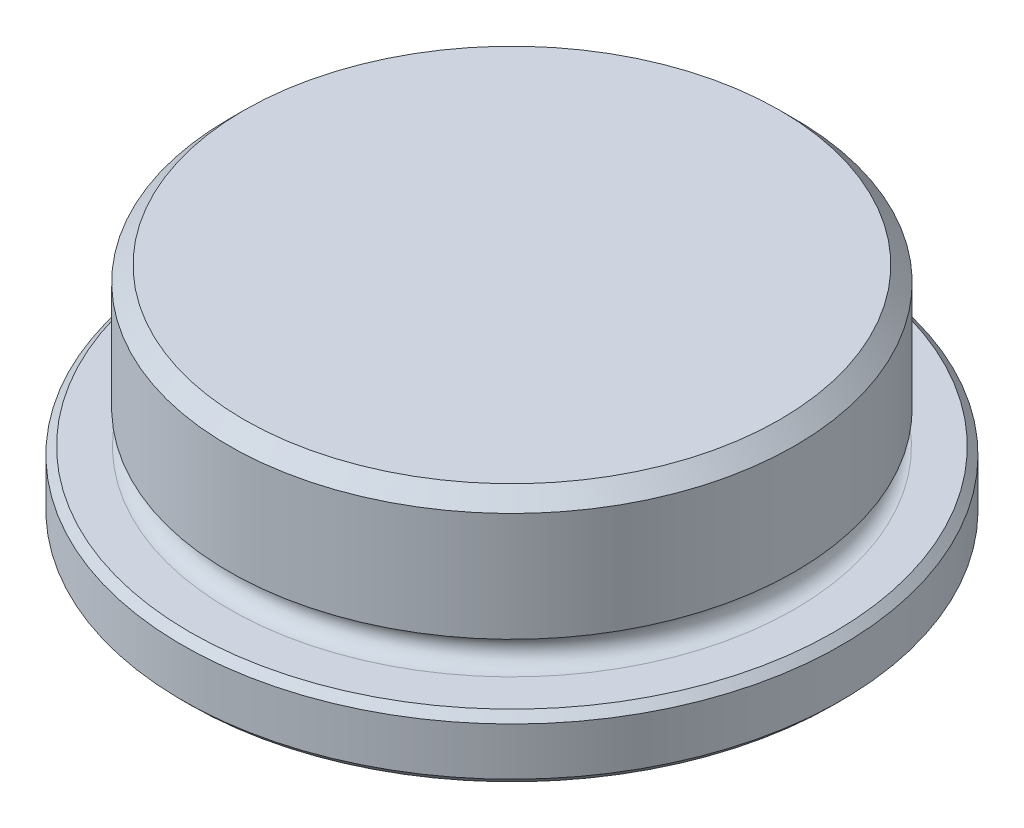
SolidWorks part; units mm, degrees
ref_plane "Front Plane" through (0, 0, 0) normal (0, 0, 1) x (1, 0, 0)
ref_plane "Top Plane" through (0, 0, 0) normal (0, 1, 0) x (1, 0, 0)
ref_plane "Right Plane" through (0, 0, 0) normal (1, 0, 0) x (0, 0, -1)
sketch "Sketch1" plane through (0, 0, 0) normal (0, 0, 1) x (1, 0, 0)
  line L0 (0, 0) -> (16.256, 0)
  line L1 (16.637, 0.381) -> (16.637, 2.794)
  line L2 (16.256, 3.175) -> (14.6662, 3.175)
  line L3 (14.2875, 4.8356) -> (14.2875, 10.3378)
  line L4 (13.5255, 11.0998) -> (0, 11.0998)
  line L5 (0, 11.0998) -> (0, 0)
  line L6 (0, -6.2671) -> (0, 6.2671) construction
  line L7 (18.3007, 0) -> (-18.3007, 0) construction
  line L8 (16.256, 0) -> (16.637, 0.381)
  line L9 (16.637, 2.794) -> (16.256, 3.175)
  line L10 (14.2875, 10.3378) -> (13.5255, 11.0998)
  line L11 (14.6662, 3.175) -> (14.262, 3.175)
  line L12 (13.9884, 4.7268) -> (14.2875, 4.8356)
  arc A1 (14.262, 3.175) -> (13.9884, 4.7268) centre (14.262, 3.975) cw
  point P1 (16.637, 0)
  point P3 (16.637, 3.175)
  point P6 (14.2875, 11.0998)
  dimension "D5" = 1.6606
  dimension "D6" = 0.8
  dimension "D7" = 13.462
  dimension "D1" = 16.637
  dimension "D2" = 11.0998
  dimension "D3" = 3.175
  dimension "D4" = 14.2875
  dimension "D11" = 20
revolve "Revolve1" add sketch "Sketch1" angle 360 about L5
sketch "Sketch2" plane through (0, 0, 0) normal (0, -1, 0) x (1, 0, 0)
  line L1 (-2.7496, 4.7625) -> (-5.4993, 0)
  line L2 (-5.4993, 0) -> (-2.7496, -4.7625)
  line L3 (-2.7496, -4.7625) -> (2.7496, -4.7625)
  line L4 (2.7496, -4.7625) -> (5.4993, 0)
  line L5 (5.4993, 0) -> (2.7496, 4.7625)
  line L6 (2.7496, 4.7625) -> (-2.7496, 4.7625)
  circle A0 centre (0, 0) radius 4.7625 construction
  dimension "D1" = 9.525
extrude "Cut-Extrude1" cut sketch "Sketch2" against normal blind 7.874
sketch "Sketch8" plane through (0, 0, 0) normal (0, 0, 1) x (1, 0, 0)
  line L0 (-5.7533, 0) -> (-2.0498, 3.7035)
  line L1 (-16.256, 0) -> (16.256, 0) construction
  line L3 (-2.0498, 3.7035) -> (0, 3.7035)
  line L4 (0, 3.7035) -> (0, 0)
  line L5 (0, 0) -> (-5.7533, 0)
  line L7 (-5.4993, 7.874) -> (-5.4993, 0) construction
  line L8 (0, 3.7035) -> (0, -0.942) construction
  dimension "D1" = 45
  dimension "D2" = 0.254
  dimension "D3" = 3.7035
revolve "Cut-Revolve1" cut sketch "Sketch8" angle 360 about L8
